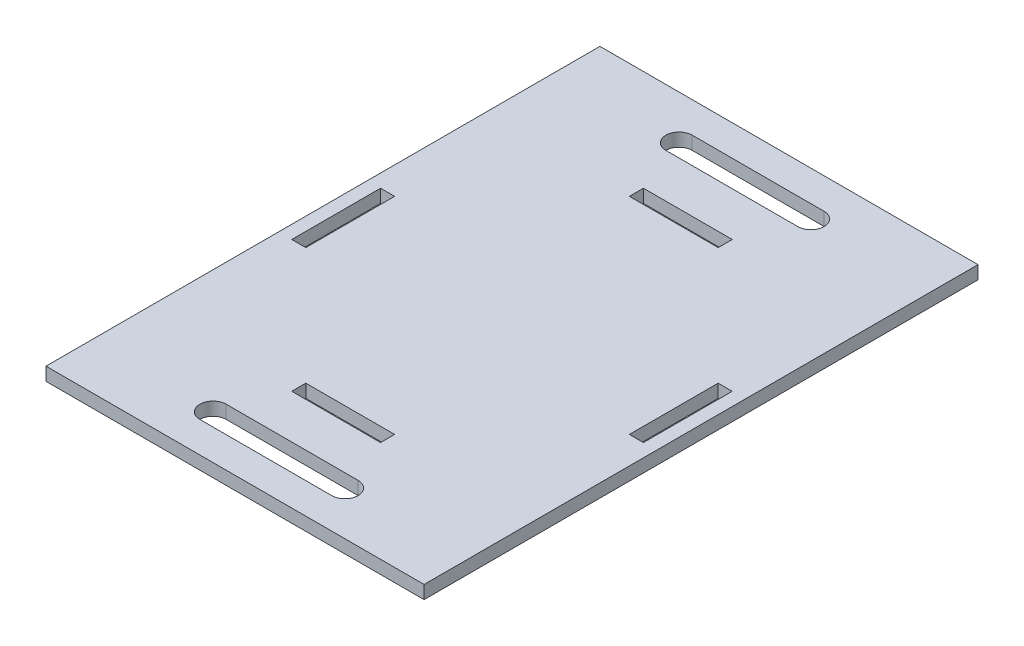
SolidWorks part; units mm, degrees
ref_plane "Alzado" through (0, 0, 0) normal (0, 0, 1) x (1, 0, 0)
ref_plane "Planta" through (0, 0, 0) normal (0, 1, 0) x (1, 0, 0)
ref_plane "Vista lateral" through (0, 0, 0) normal (1, 0, 0) x (0, 0, -1)
sketch "Croquis1" plane through (0, 0, 0) normal (0, 1, 0) x (1, 0, 0)
  line L0 (-215, -215) -> (-215, 215)
  line L1 (200, -200) -> (-200, -200) construction
  line L2 (200, -200) -> (200, 200) construction
  line L3 (200, 200) -> (-200, 200) construction
  line L4 (-200, -200) -> (-200, 200) construction
  line L5 (200, -200) -> (-200, 200) construction
  line L6 (200, 200) -> (-200, -200) construction
  line L7 (215, 215) -> (-215, 215)
  line L8 (215, -215) -> (215, 215)
  line L9 (215, -215) -> (-215, -215)
  line L10 (0, 0) -> (0, -200) construction
  line L11 (200, 50.5) -> (184, 50.5)
  line L12 (200, 50.5) -> (200, -50.5)
  line L13 (200, -50.5) -> (184, -50.5)
  line L14 (184, 50.5) -> (184, -50.5)
  line L15 (-184, 50.5) -> (-184, -50.5)
  line L16 (-200, -50.5) -> (-184, -50.5)
  line L17 (-200, 50.5) -> (-200, -50.5)
  line L18 (-200, 50.5) -> (-184, 50.5)
  line L19 (0, 0) -> (-95.1616, 0) construction
  line L20 (-50.5, 200) -> (50.5, 200)
  line L21 (-50.5, 200) -> (-50.5, 184)
  line L22 (-50.5, 184) -> (50.5, 184)
  line L23 (50.5, 200) -> (50.5, 184)
  line L24 (50.5, -200) -> (50.5, -184)
  line L25 (-50.5, -184) -> (50.5, -184)
  line L26 (-50.5, -200) -> (-50.5, -184)
  line L27 (-50.5, -200) -> (50.5, -200)
  point P0 (0, 0)
  point P14 (184, 0)
  point P25 (0, 184)
extrude "Saliente-Extruir1" add sketch "Croquis1" along normal blind 15
sketch "Croquis2" plane through (0, 15, 0) normal (0, 1, 0) x (1, 0, 0)
  line L0 (75, 265) -> (-75, 265) construction
  line L1 (-215, 215) -> (215, 215)
  line L2 (-215, 215) -> (-215, 315)
  line L3 (-215, 315) -> (215, 315)
  line L4 (215, 215) -> (215, 315)
  line L5 (75, 250) -> (-75, 250)
  line L6 (75, 280) -> (-75, 280)
  line L7 (215, -215) -> (215, 215) construction
  line L8 (0, 0) -> (215, 0) construction
  line L9 (215, -215) -> (215, -315)
  line L10 (-215, -315) -> (215, -315)
  line L11 (-215, -215) -> (-215, -315)
  line L12 (-215, -215) -> (215, -215)
  line L13 (75, -265) -> (-75, -265) construction
  line L14 (75, -250) -> (-75, -250)
  line L15 (75, -280) -> (-75, -280)
  arc A0 (75, 250) -> (75, 280) centre (75, 265) ccw
  arc A1 (-75, 280) -> (-75, 250) centre (-75, 265) ccw
  arc A2 (75, -250) -> (75, -280) centre (75, -265) cw
  arc A3 (-75, -280) -> (-75, -250) centre (-75, -265) cw
  point P7 (0, 265)
  point P18 (-215, 265)
  point P25 (0, -265)
  dimension "D3" = 15
  dimension "D1" = 100
  dimension "D2" = 150
extrude "Saliente-Extruir2" add sketch "Croquis2" against normal blind 15
equation "\"D1@Croquis1\" = \"profbase\""
equation "\"D2@Croquis1\" = \"anchbase\""
equation "\"thicknes\"=15"
equation "\"D1@Saliente-Extruir1\"=\"thicknes\""
equation "\"profbase\"= 400"
equation "\"anchbase\"= 400"
equation "\"altura\"=150"
equation "\"D3@Croquis1\"=\"thicknes\""
equation "\"clearens\"=1"
equation "\"D4@Croquis1\"=\"thicknes\"+\"clearens\""
equation "\"joind1\"=100"
equation "\"D5@Croquis1\"=\"joind1\"+\"clearens\""
equation "\"D6@Croquis1\"=\"thicknes\"+\"clearens\""
equation "\"D7@Croquis1\"=\"joind1\"+\"clearens\""
equation "\"D1@Saliente-Extruir2\"=\"thicknes\""
